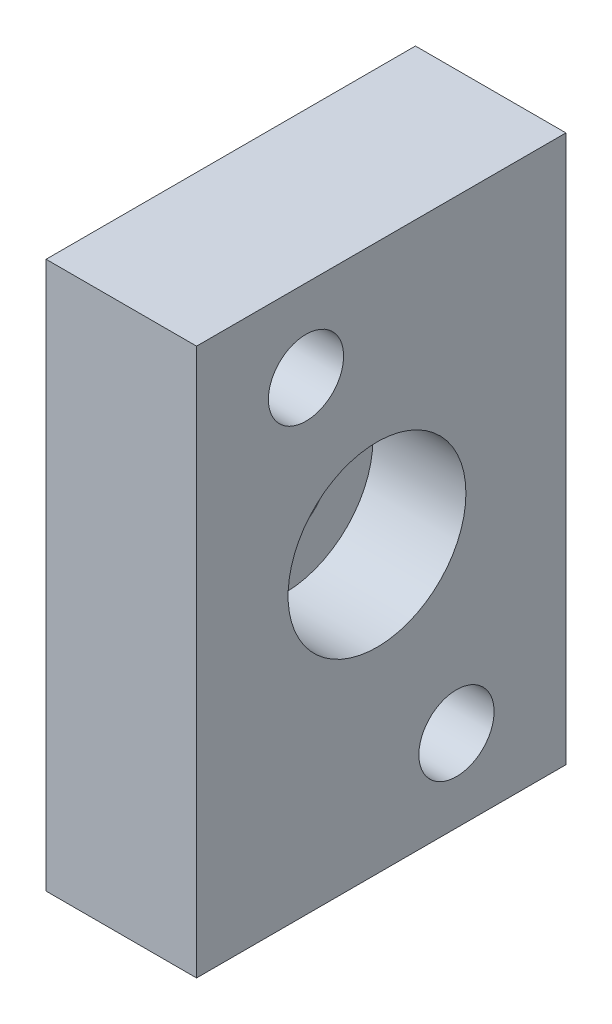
SolidWorks part; units mm, degrees
ref_plane "Plan de face" through (0, 0, 0) normal (0, 0, 1) x (1, 0, 0)
ref_plane "Plan de dessus" through (0, 0, 0) normal (0, 1, 0) x (1, 0, 0)
ref_plane "Plan de droite" through (0, 0, 0) normal (1, 0, 0) x (0, 0, -1)
imported_body "Importée1"
sketch "Esquisse1" plane through (121, 0, 0) normal (1, 0, 0) x (0, 0, -1)
  circle A0 centre (15.81, -42.687) radius 6.5 construction
  circle A1 centre (15.81, -42.687) radius 6.5
extrude "Extrusion1" add sketch "Esquisse1" against normal up to surface (11 mm away)
sketch "Esquisse2" plane through (121, 0, 0) normal (1, 0, 0) x (0, 0, -1)
  line L0 (29, -21.85) -> (2, -21.85) construction
  line L1 (2, -21.85) -> (2, -61.85) construction
  circle A0 centre (15.19, -41.01) radius 6.5
  dimension "D1" = 13
  dimension "D2" = 19.16
  dimension "D3" = 13.19
extrude "Extrusion2" cut sketch "Esquisse2" against normal blind 6.8
sketch "Esquisse3" plane through (114.2, 0, 0) normal (1, 0, 0) x (0, 0, -1)
  circle A0 centre (15.19, -41.01) radius 3.2
  dimension "D1" = 6.4
extrude "Extrusion3" cut sketch "Esquisse3" against normal through all
sketch "Esquisse4" plane through (110, 0, 0) normal (-1, 0, 0) x (0, 0, 1)
  circle A0 centre (-21, -53.85) radius 4.5 construction
  circle A1 centre (-21, -53.85) radius 4.5
  circle A2 centre (-8, -29.85) radius 4.5 construction
  circle A3 centre (-8, -29.85) radius 4.5
extrude "Extrusion4" add sketch "Esquisse4" against normal up to surface (11 mm away)
sketch "Esquisse5" plane through (110, 0, 0) normal (-1, 0, 0) x (0, 0, 1)
  line L0 (-29, -21.85) -> (-2, -21.85) construction
  line L1 (-2, -21.85) -> (-2, -61.85) construction
  line L2 (-29, -61.85) -> (-29, -21.85) construction
  line L3 (-2, -61.85) -> (-29, -61.85) construction
  circle A0 centre (-10, -27.85) radius 4.5
  circle A1 centre (-21, -55.85) radius 4.5
  dimension "D1" = 9
  dimension "D2" = 9
  dimension "D4" = 8
  dimension "D5" = 8
  dimension "D6" = 6
  dimension "D3" = 6
extrude "Extrusion5" cut sketch "Esquisse5" against normal blind 5.2
sketch "Esquisse6" plane through (115.2, 0, 0) normal (-1, 0, 0) x (0, 0, 1)
  circle A0 centre (-10, -27.85) radius 2.75
  circle A1 centre (-21, -55.85) radius 2.75
  dimension "D1" = 5.5
  dimension "D2" = 5.5
extrude "Extrusion6" cut sketch "Esquisse6" against normal through all
